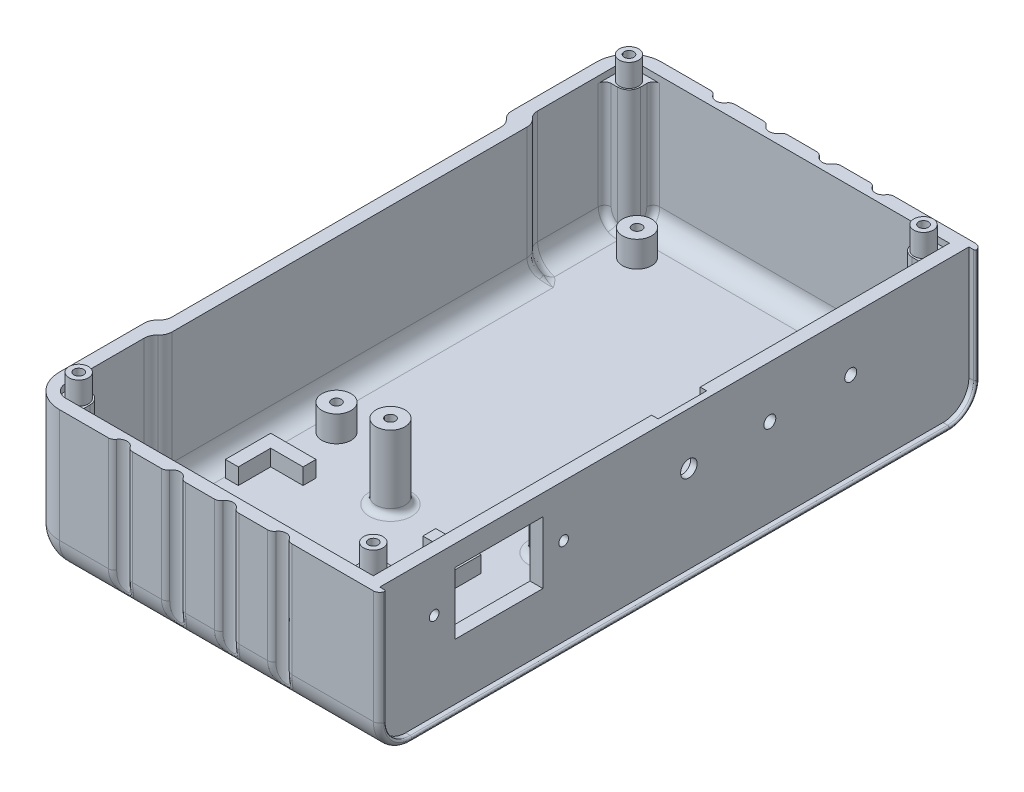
SolidWorks part; units mm, degrees
ref_plane "Front Plane" through (0, 0, 0) normal (0, 0, 1) x (1, 0, 0)
ref_plane "Top Plane" through (0, 0, 0) normal (0, 1, 0) x (1, 0, 0)
ref_plane "Right Plane" through (0, 0, 0) normal (1, 0, 0) x (0, 0, -1)
sketch "Sketch1" plane through (0, 0, 0) normal (0, 1, 0) x (1, 0, 0)
  line L0 (-53.5, 93) -> (-53.5, 53)
  line L1 (-53.5, 93) -> (53.5, 93)
  line L3 (-53.5, -93) -> (53.5, -93)
  line L4 (53.5, 93) -> (53.5, -93)
  line L5 (-53.5, 93) -> (53.5, -93) construction
  line L6 (-53.5, -93) -> (53.5, 93) construction
  line L7 (-53.5, 53) -> (-50.85, 53)
  line L8 (-50.85, 53) -> (-50.85, -53)
  line L9 (-50.85, -53) -> (-53.5, -53)
  line L10 (-53.5, -53) -> (-53.5, -93)
  point P0 (0, 0)
extrude "Boss-Extrude1" add sketch "Sketch1" along normal blind 4
sketch "Sketch2" plane through (0, 4, 0) normal (0, 1, 0) x (1, 0, 0)
  line L0 (-53.5, 93) -> (-53.5, 53)
  line L1 (-53.5, 93) -> (53.5, 93)
  line L3 (-53.5, -93) -> (53.5, -93)
  line L4 (53.5, 93) -> (53.5, -93)
  line L5 (-53.5, 93) -> (53.5, -93) construction
  line L6 (-53.5, -93) -> (53.5, 93) construction
  line L7 (-53.5, 53) -> (-50.85, 53)
  line L8 (-50.85, 53) -> (-50.85, -53)
  line L9 (-53.5, -93) -> (-53.5, -53)
  line L10 (-53.5, -53) -> (-53.5, -93) construction
  line L11 (-53.5, -53) -> (-50.85, -53)
  line L12 (-49.5, 89) -> (49.5, 89)
  line L13 (49.5, 89) -> (49.5, -89)
  line L14 (-49.5, -89) -> (49.5, -89)
  line L15 (-49.5, -89) -> (-49.5, -57)
  line L16 (-49.5, -57) -> (-46.85, -57)
  line L17 (-46.85, 57) -> (-46.85, -57)
  line L18 (-49.5, 57) -> (-46.85, 57)
  line L19 (-49.5, 89) -> (-49.5, 57)
  point P0 (0, 0)
extrude "Boss-Extrude2" add sketch "Sketch2" along normal blind 41
sketch "Sketch3" plane through (0, 4, 0) normal (0, 1, 0) x (1, 0, 0)
  line L0 (-49.5, 89) -> (-49.5, 57) construction
  line L3 (49.5, 89) -> (-49.5, 89) construction
  line L4 (49.5, -89) -> (49.5, 89) construction
  line L5 (49.5, 89) -> (-49.5, 89) construction
  line L6 (-49.5, -89) -> (49.5, -89) construction
  line L7 (-49.5, -57) -> (-49.5, -89) construction
  circle A0 centre (-45.5, 85) radius 3.5
  circle A1 centre (45.5, 85) radius 3.5
  circle A2 centre (45.5, -85) radius 3.5
  circle A3 centre (-45.5, -85) radius 3.5
  dimension "D1" = 7
  dimension "D2" = 4
  dimension "D3" = 4
  dimension "D4" = 4
  dimension "D5" = 4
  dimension "D6" = 4
  dimension "D7" = 4
  dimension "D8" = 4
  dimension "D9" = 4
extrude "Boss-Extrude3" add sketch "Sketch3" along normal blind 39
sketch "Sketch4" plane through (0, 4, 0) normal (0, 1, 0) x (1, 0, 0)
  line L0 (-49.5, 89) -> (-42, 89)
  line L1 (49.5, 89) -> (-49.5, 89) construction
  line L2 (-42, 89) -> (-42, 85)
  line L3 (-42, 85) -> (-45.5, 81.5)
  line L4 (-45.5, 81.5) -> (-49.5, 81.5)
  line L5 (-49.5, 89) -> (-49.5, 57) construction
  line L6 (-49.5, 81.5) -> (-49.5, 89)
  line L7 (42, 89) -> (49.5, 89)
  line L8 (49.5, 89) -> (-49.5, 89) construction
  line L9 (49.5, 89) -> (49.5, 81.5)
  line L10 (49.5, -89) -> (49.5, 89) construction
  line L11 (49.5, 81.5) -> (45.5, 81.5)
  line L12 (45.5, 81.5) -> (42, 85)
  line L13 (42, 85) -> (42, 89)
  line L14 (42, -89) -> (49.5, -89)
  line L15 (-49.5, -89) -> (49.5, -89) construction
  line L16 (49.5, -89) -> (49.5, -81.5)
  line L17 (49.5, -81.5) -> (45.5, -81.5)
  line L18 (45.5, -81.5) -> (42, -85)
  line L19 (42, -85) -> (42, -89)
  line L20 (-49.5, -81.5) -> (-45.5, -81.5)
  line L21 (-49.5, -57) -> (-49.5, -89) construction
  line L22 (-45.5, -81.5) -> (-42, -85)
  line L23 (-42, -85) -> (-42, -89)
  line L24 (-49.5, -89) -> (49.5, -89) construction
  line L25 (-42, -89) -> (-49.5, -89)
  line L26 (-49.5, -89) -> (-49.5, -81.5)
extrude "Boss-Extrude4" add sketch "Sketch4" along normal blind 39
sketch "Sketch5" plane through (0, 0, 0) normal (0, -1, 0) x (1, 0, 0)
  circle A0 centre (45.5, 85) radius 2.75
  circle A1 centre (-45.5, 85) radius 2.75
  circle A2 centre (-45.5, -85) radius 2.75
  circle A3 centre (45.5, -85) radius 2.75
  dimension "D1" = 5.5
extrude "Cut-Extrude1" cut sketch "Sketch5" against normal blind 40
sketch "Sketch6" plane through (0, 43, 0) normal (0, 1, 0) x (1, 0, 0)
  circle A0 centre (-45.5, 85) radius 3
  circle A1 centre (45.5, 85) radius 3
  circle A2 centre (45.5, -85) radius 3
  circle A3 centre (-45.5, -85) radius 3
  dimension "D1" = 6
extrude "Boss-Extrude5" add sketch "Sketch6" along normal blind 7
sketch "Sketch7" plane through (0, 50, 0) normal (0, 1, 0) x (1, 0, 0)
  circle A0 centre (-45.5, 85) radius 1.5
  circle A1 centre (45.5, 85) radius 1.5
  circle A2 centre (45.5, -85) radius 1.5
  circle A3 centre (-45.5, -85) radius 1.5
  dimension "D1" = 3
extrude "Cut-Extrude2" cut sketch "Sketch7" against normal blind 10
fillet "Fillet1" radius 6 3 edges at (0, 4, 89) (0, 4, -89) (-49.5, 4, 69.25)
fillet "Fillet2" radius 2 26 edges at (42, 26.5, 89) (42, 6.5359, 87.899) (42.1634, 4.0746, 83.943) (43.8798, 4, 81.8976) (49.5, 23.5, 81.5) (49.5, 23.5, -81.5) (43.8798, 4, -81.8976) (42.149, 4.0822, -83.9897) (42, 6.5359, -87.899) (42, 26.5, -89) (-42, 26.5, -89) (-42, 6.5359, -87.899) (-42.1634, 4.0746, -83.943) (-43.0251, 4, -82.5251) (-49.5, 26.5, -81.5) (-49.5, 26.5, 81.5) (-48.399, 6.5359, 81.5) (-44.443, 4.0746, 81.6634) (-43.0251, 4, 82.5251) (-42.149, 4.0822, 83.9897) (-42, 6.5359, 87.899) (-42, 26.5, 89) (47.5, 4, 81.5) (47.5, 4, -81.5) (-44.4897, 4.0822, -81.649) (-48.399, 6.5359, -81.5)
sketch "Sketch8" plane through (0, 4, 0) normal (0, 1, 0) x (1, 0, 0)
  line L0 (49.5, 78) -> (29.5, 78) construction
  line L1 (49.5, -79.5) -> (49.5, 79.5) construction
  line L2 (-40, 89) -> (40, 89) construction
  circle A0 centre (29.5, 78) radius 4.5
  circle A1 centre (29.5, -14.532) radius 4.5
  circle A2 centre (-35.981, 77.975) radius 4.5
  circle A3 centre (-35.676, -15.192) radius 4.5
extrude "Boss-Extrude6" add sketch "Sketch8" along normal blind 8
sketch "Sketch9" plane through (0, 12, 0) normal (0, 1, 0) x (1, 0, 0)
  circle A0 centre (29.5, 78) radius 1.5
  circle A1 centre (-35.981, 77.975) radius 1.5
  circle A2 centre (29.5, -14.532) radius 1.5
  circle A3 centre (-35.676, -15.192) radius 1.5
  dimension "D1" = 3
extrude "Cut-Extrude3" cut sketch "Sketch9" against normal blind 8
sketch "Sketch10" plane through (0, 4, 0) normal (0, 1, 0) x (1, 0, 0)
  line L0 (10.5, -30.692) -> (24.5, -30.692)
  line L1 (24.5, -30.692) -> (24.5, -44.692)
  line L2 (24.5, -44.692) -> (20.5, -44.692)
  line L3 (20.5, -44.692) -> (20.5, -34.692)
  line L4 (20.5, -34.692) -> (10.5, -34.692)
  line L5 (10.5, -34.692) -> (10.5, -30.692)
  line L6 (-26.5, -30.692) -> (-40.5, -30.692)
  line L7 (-40.5, -30.692) -> (-40.5, -44.692)
  line L8 (-40.5, -44.692) -> (-36.5, -44.692)
  line L9 (-36.5, -44.692) -> (-36.5, -34.692)
  line L10 (-36.5, -34.692) -> (-26.5, -34.692)
  line L11 (-26.5, -34.692) -> (-26.5, -30.692)
  line L12 (-40.5, -57.692) -> (-40.5, -71.692)
  line L13 (-40.5, -71.692) -> (-26.5, -71.692)
  line L14 (-26.5, -71.692) -> (-26.5, -67.692)
  line L15 (-26.5, -67.692) -> (-36.5, -67.692)
  line L16 (-36.5, -67.692) -> (-36.5, -57.692)
  line L17 (-36.5, -57.692) -> (-40.5, -57.692)
  line L18 (10.5, -71.692) -> (24.5, -71.692)
  line L19 (24.5, -71.692) -> (24.5, -57.692)
  line L20 (24.5, -57.692) -> (20.5, -57.692)
  line L21 (20.5, -57.692) -> (20.5, -67.692)
  line L22 (20.5, -67.692) -> (10.5, -67.692)
  line L23 (10.5, -67.692) -> (10.5, -71.692)
  line L24 (49.5, -89) -> (49.5, 89) construction
  line L26 (-35.676, -15.192) -> (-35.676, -34.692) construction
  dimension "D10" = 19.5
  dimension "D1" = 4
  dimension "D2" = 14
  dimension "D3" = 57
  dimension "D4" = 57
  dimension "D5" = 33
  dimension "D6" = 33
  dimension "D7" = 0
  dimension "D8" = 25
  dimension "D9" = 0
extrude "Boss-Extrude7" add sketch "Sketch10" along normal blind 5
sketch "Sketch11" plane through (0, 4, 0) normal (0, 1, 0) x (1, 0, 0)
  line L0 (24.5, -30.692) -> (10.5, -30.692) construction
  line L1 (10.5, -71.692) -> (24.5, -71.692) construction
  circle A0 centre (-8, -26.192) radius 4.5
  circle A1 centre (-8, -76.192) radius 4.5
  dimension "D1" = 9
  dimension "D2" = 9
  dimension "D3" = 4.5
  dimension "D4" = 4.5
  dimension "D5" = 28.5
  dimension "D6" = 28.5
extrude "Boss-Extrude8" add sketch "Sketch11" along normal blind 23
sketch "Sketch12" plane through (0, 27, 0) normal (0, 1, 0) x (1, 0, 0)
  circle A0 centre (-8, -26.192) radius 1.5
  circle A1 centre (-8, -76.192) radius 1.5
  dimension "D1" = 3
  dimension "D2" = 3
extrude "Cut-Extrude4" cut sketch "Sketch12" against normal blind 10
fillet "Fillet3" radius 2 2 edges at (-8, 4, 80.692) (-8, 4, 30.692)
sketch "Sketch13" plane through (53.5, 0, 0) normal (1, 0, 0) x (0, 0, -1)
  line L0 (93, 4) -> (79.5, 4) construction
  line L1 (93, 45) -> (93, 0) construction
  line L2 (-93, 0) -> (93, 0) construction
  line L4 (79.5, 4) -> (-54.19, 4) construction
  line L5 (-54.19, 4) -> (-54.19, 29) construction
  line L6 (-78.69, 40.15) -> (-29.69, 40.15) construction
  line L7 (-67.79, 38.6) -> (-40.59, 38.6)
  line L8 (-67.79, 38.6) -> (-67.79, 19.4)
  line L9 (-67.79, 19.4) -> (-40.59, 19.4)
  line L10 (-40.59, 38.6) -> (-40.59, 19.4)
  line L11 (-67.79, 38.6) -> (-40.59, 19.4) construction
  line L12 (-67.79, 19.4) -> (-40.59, 38.6) construction
  line L13 (-78.69, 40.15) -> (-78.69, 17.85) construction
  line L14 (-78.69, 17.85) -> (-29.69, 17.85) construction
  line L15 (-29.69, 40.15) -> (-29.69, 17.85) construction
  line L16 (-78.69, 40.15) -> (-29.69, 17.85) construction
  line L17 (-78.69, 17.85) -> (-29.69, 40.15) construction
  circle A0 centre (54.5, 29) radius 6 construction
  circle A1 centre (29.5, 29) radius 6 construction
  circle A2 centre (4.5, 29) radius 2.55
  circle A3 centre (29.5, 29) radius 1.85
  circle A4 centre (54.5, 29) radius 1.85
  circle A5 centre (-74.19, 29) radius 1.5
  circle A6 centre (-34.19, 29) radius 1.5
extrude "Cut-Extrude5" cut sketch "Sketch13" against normal blind 4
sketch "Sketch14" plane through (49.5, 0, 0) normal (-1, 0, 0) x (0, 0, 1)
  line L0 (-4.5, 29) -> (-12, 29) construction
  line L1 (3, 45) -> (-12, 45)
  line L2 (3, 45) -> (3, 21.5)
  line L3 (3, 21.5) -> (-12, 21.5)
  line L4 (-12, 45) -> (-12, 21.5)
  line L5 (-4.5, 29) -> (-4.5, 45) construction
  line L6 (-4.5, 29) -> (3, 29) construction
  line L7 (-4.5, 29) -> (-4.5, 21.5) construction
extrude "Cut-Extrude6" cut sketch "Sketch14" against normal blind 2
fillet "Fillet4" radius 6 1 edges at (-46.85, 5.0223, 0)
fillet "Fillet5" radius 4 2 edges at (-53.5, 22.5, 53) (-53.5, 22.5, -53)
fillet "Fillet6" radius 4 2 edges at (-50.85, 22.5, 53) (-50.85, 22.5, -53)
fillet "Fillet7" radius 10 11 edges at (-53.5, 0, -74.8827) (-53.1538, 0, -55.1374) (-51.1962, 0, -52.4453) (-50.85, 0, 0) (-51.1962, 0, 52.4453) (-53.1538, 0, 55.1374) (-53.5, 0, 74.8827) (-53.5, 22.5, 93) (0, 0, -93) (0, 0, 93) (-53.5, 22.5, -93)
fillet "Fillet8" radius 4 2 edges at (-49.5, 44, -89) (-49.5, 44, 89)
sketch "Sketch15" plane through (0, 45, 0) normal (0, 1, 0) x (1, 0, 0)
  line L0 (53.5, 93) -> (-43.5, 93) construction
  line L1 (-43.5, -93) -> (53.5, -93) construction
  line L2 (-27.0541, 93) -> (-22.1551, 93)
  line L3 (-10.651, 93) -> (-5.752, 93)
  line L4 (5.752, 93) -> (10.651, 93)
  line L5 (22.1551, 93) -> (27.0541, 93)
  line L6 (27.0541, -93) -> (22.1551, -93)
  line L7 (10.651, -93) -> (5.752, -93)
  line L8 (-5.752, -93) -> (-10.651, -93)
  line L9 (-22.1551, -93) -> (-27.0541, -93)
  line L10 (41, 93) -> (24.6046, 93.5) construction
  line L11 (24.6046, 93.5) -> (8.2015, 93.5) construction
  line L12 (8.2015, 93.5) -> (-8.2015, 93.5) construction
  line L13 (-8.2015, 93.5) -> (-24.6046, 93.5) construction
  line L14 (-24.6046, 93.5) -> (-41, 93) construction
  line L15 (24.6046, -93.5) -> (41, -93) construction
  line L16 (24.6046, -93.5) -> (8.2015, -93.5) construction
  line L17 (8.2015, -93.5) -> (-8.2015, -93.5) construction
  line L18 (-8.2015, -93.5) -> (-24.6046, -93.5) construction
  line L19 (-24.6046, -93.5) -> (-41, -93) construction
  line L20 (42, 87) -> (42, 85) construction
  line L22 (-42, 85) -> (-42, 87) construction
  line L25 (42, -85) -> (42, -87) construction
  line L26 (-42, -87) -> (-42, -85) construction
  arc A0 (27.0541, 93) -> (22.1551, 93) centre (24.6046, 93.5) cw
  arc A1 (10.651, 93) -> (5.752, 93) centre (8.2015, 93.5) cw
  arc A2 (-5.752, 93) -> (-10.651, 93) centre (-8.2015, 93.5) cw
  arc A3 (-22.1551, 93) -> (-27.0541, 93) centre (-24.6046, 93.5) cw
  arc A4 (22.1551, -93) -> (27.0541, -93) centre (24.6046, -93.5) cw
  arc A5 (5.752, -93) -> (10.651, -93) centre (8.2015, -93.5) cw
  arc A6 (-10.651, -93) -> (-5.752, -93) centre (-8.2015, -93.5) cw
  arc A7 (-27.0541, -93) -> (-22.1551, -93) centre (-24.6046, -93.5) cw
  point P34 (42, 86)
  dimension "D13" = 2.5
  dimension "D14" = 2.5
  dimension "D15" = 2.5
  dimension "D16" = 2.5
  dimension "D17" = 2.5
  dimension "D18" = 2.5
  dimension "D19" = 2.5
  dimension "D20" = 2.5
  dimension "D1" = 0.5
  dimension "D2" = 0.5
  dimension "D3" = 0.5
  dimension "D4" = 0.5
  dimension "D5" = 0.5
  dimension "D6" = 0.5
  dimension "D7" = 0.5
  dimension "D8" = 0.5
  dimension "D9" = 1
  dimension "D10" = 1
  dimension "D11" = 1
  dimension "D12" = 1
extrude "Cut-Extrude7" cut sketch "Sketch15" against normal blind 91
fillet "Fillet9" radius 2 24 edges at (24.3405, 4.0187, -91.014) (7.9374, 4.0187, -91.014) (-8.4656, 4.0187, -91.014) (-24.8687, 4.0187, -91.014) (-24.3405, 4.0187, 91.014) (-7.9374, 4.0187, 91.014) (8.4656, 4.0187, 91.014) (24.8687, 4.0187, 91.014) (22.1551, 27.5, 93) (27.0541, 27.5, 93) (-22.1551, 27.5, -93) (-27.0541, 27.5, -93) (-5.752, 27.5, -93) (-10.651, 27.5, -93) (10.651, 27.5, -93) (5.752, 27.5, -93) (5.752, 27.5, 93) (10.651, 27.5, 93) (-10.651, 27.5, 93) (-5.752, 27.5, 93) (-27.0541, 27.5, 93) (-22.1551, 27.5, 93) (27.0541, 27.5, -93) (22.1551, 27.5, -93)
fillet "Fillet10" radius 4 6 edges at (-42.175, 4, -57) (-47.7426, 5.7574, -57) (-49.5, 27.5, -57) (-42.175, 4, 57) (-47.7426, 5.7574, 57) (-49.5, 27.5, 57)
fillet "Fillet11" radius 4 6 edges at (-43.5252, 4.6294, 57) (-46.5392, 8.0941, 57) (-43.5252, 4.6294, -57) (-46.5392, 8.0941, -57) (-46.85, 27.5, 57) (-46.85, 27.5, -57)
fillet "Fillet12" radius 2 1 edges at (29.5, 4, 19.032)
sketch "Sketch16" plane through (53.5, 0, 0) normal (1, 0, 0) x (0, 0, -1)
  line L0 (-93, 45) -> (-93, 10)
  line L1 (-83, 0) -> (83, 0)
  line L2 (93, 45) -> (93, 10)
  line L3 (91, 45) -> (91, 10)
  line L4 (-83, 2) -> (83, 2)
  line L5 (-91, 45) -> (-91, 10)
  line L6 (-93, 45) -> (-91, 45)
  line L7 (91, 45) -> (93, 45)
  arc A0 (-93, 10) -> (-83, 0) centre (-83, 10) ccw construction
  arc A1 (-93, 10) -> (-83, 0) centre (-83, 10) ccw
  arc A2 (93, 10) -> (83, 0) centre (83, 10) cw
  arc A3 (91, 10) -> (83, 2) centre (83, 10) cw
  arc A4 (-91, 10) -> (-83, 2) centre (-83, 10) ccw
  dimension "D1" = 2
extrude "Boss-Extrude9" add sketch "Sketch16" along normal blind 2
fillet "Fillet13" radius 2 5 edges at (55.5, 27.5, 93) (55.5, 2.9289, 90.0711) (55.5, 0, 0) (55.5, 2.9289, -90.0711) (55.5, 27.5, -93)
fillet "Fillet14" radius 0.5 5 edges at (55.5, 27.5, 91) (55.5, 4.3431, 88.6569) (55.5, 2, 0) (55.5, 4.3431, -88.6569) (55.5, 27.5, -91)
equation "\"Total_Width\"= 120 - 6 - 7"
equation "\"D1@Sketch1\" = \"Total_Width\""
equation "\"Total_Length\"= 200 - 14"
equation "\"D2@Sketch1\" = \"Total_Length\""
equation "\"Cutout_Left_Offset\"= 40"
equation "\"Cutout_Depth\"= 2.65"
equation "\"D5@Sketch1\" = \"Cutout_Depth\""
equation "\"D3@Sketch1\" = \"Cutout_Left_Offset\""
equation "\"Cutout_Length\" = \"Total_Length\" - 2 * \"Cutout_Left_Offset\""
equation "\"D4@Sketch1\" = \"Cutout_Length\""
equation "\"D6@Sketch1\" = \"Total_Width\" / 2"
equation "\"D1@Sketch2\" = \"Total_Width\""
equation "\"D2@Sketch2\" = \"Total_Length\""
equation "\"D3@Sketch2\" = \"Cutout_Left_Offset\""
equation "\"D4@Sketch2\" = \"Cutout_Length\""
equation "\"D5@Sketch2\" = \"Cutout_Depth\""
equation "\"D6@Sketch2\" = \"Total_Width\" / 2"
equation "\"Lower_Part_Height\"= 41"
equation "\"D1@Boss-Extrude2\" = \"Lower_Part_Height\""
equation "\"Screw_Boss_Height\"= \"Lower_Part_Height\" - 2"
equation "\"D1@Boss-Extrude3\" = \"Screw_Boss_Height\""
equation "\"D1@Sketch4\"=7.50"
equation "\"D1@Boss-Extrude4\" = \"Screw_Boss_Height\""
equation "\"D1@Cut-Extrude1\" = \"Lower_Part_Height\" - 1"
equation "\"PCB_Screw_Boss_Y\"= 20"
equation "\"D1@Sketch8\" = \"PCB_Screw_Boss_Y\""
equation "\"PCB_Screw_Boss_X\"= 11"
equation "\"D2@Sketch8\" = \"PCB_Screw_Boss_X\""
equation "\"PCB_Screw_Boss_Height\"= 8"
equation "\"D1@Boss-Extrude6\" = \"PCB_Screw_Boss_Height\""
equation "\"Ports_Y\"= 25"
equation "\"D7@Sketch13\" = \"Ports_Y\""
equation "\"D8@Sketch13\" = \"Ports_Y\""
equation "\"D9@Sketch13\" = \"Ports_Y\""
equation "\"Ports_X\"= 25"
equation "\"D11@Sketch13\" = \"Ports_X\""
equation "\"D12@Sketch13\" = \"Ports_X\""
equation "\"D10@Sketch13\" = \"Ports_X\""
equation "\"Power_Port_X\"= 133.69"
equation "\"D13@Sketch13\" = \"Power_Port_X\""
equation "\"D14@Sketch13\" = \"Ports_Y\""
equation "\"D19@Sketch13\" = \"Ports_Y\""
equation "\"D20@Sketch13\" = \"Ports_Y\""
equation "\"D1@Sketch14\" = \"Lower_Part_Height\" - \"Ports_Y\""
